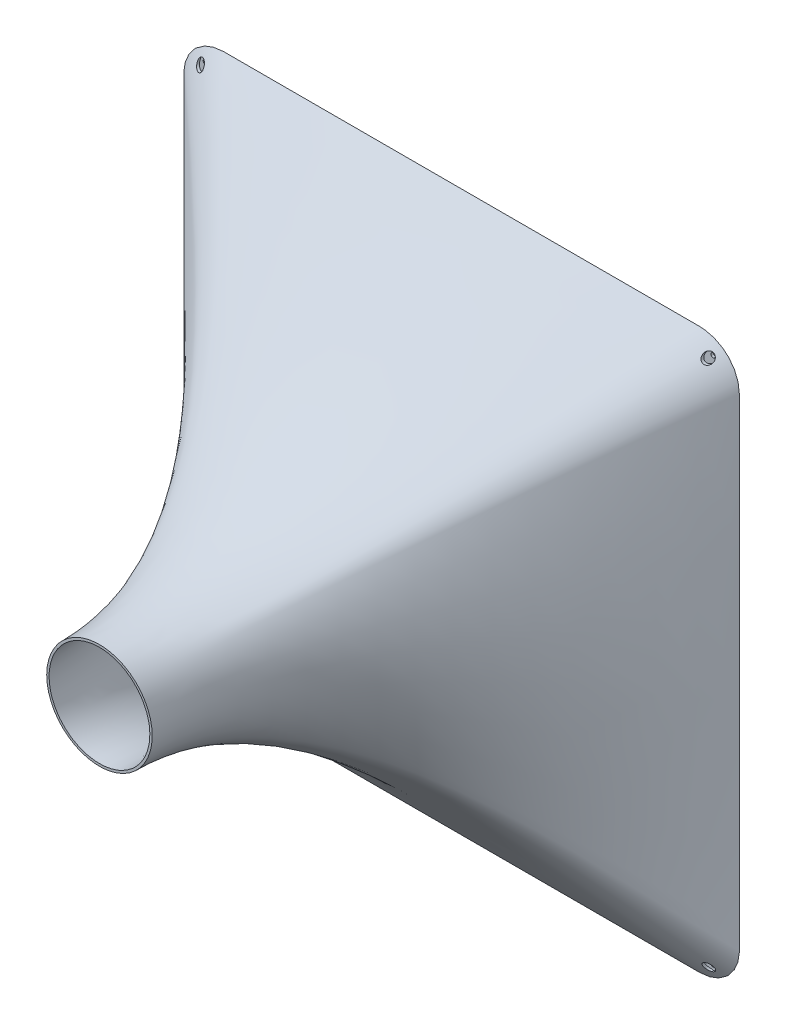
SolidWorks part; units mm, degrees
ref_plane "Front Plane" through (0, 0, 0) normal (0, 0, 1) x (1, 0, 0)
ref_plane "Top Plane" through (0, 0, 0) normal (0, 1, 0) x (1, 0, 0)
ref_plane "Right Plane" through (0, 0, 0) normal (1, 0, 0) x (0, 0, -1)
sketch "Sketch1" plane through (0, 0, 0) normal (0, 0, 1) x (1, 0, 0)
  line L4 (-300, -277.9031) -> (300, -277.9031)
  line L5 (350, -229.6068) -> (350, 378.9265)
  line L6 (300, 427.2228) -> (-300, 427.2228)
  line L7 (-350, 378.9265) -> (-350, -229.6068)
  line L8 (-300, -277.9031) -> (300, -277.9031)
  line L9 (350, -229.6068) -> (350, 378.9265)
  line L10 (300, 427.2228) -> (-300, 427.2228)
  line L11 (-350, 378.9265) -> (-350, -229.6068)
  ellipse E4 centre (-300, -229.6068) end of major axis (-350, -229.6068) minor radius 48.2963 (-350, -229.6068) -> (-300, -277.9031) ccw
  ellipse E5 centre (300, -229.6068) end of major axis (250, -229.6068) minor radius 48.2963 (300, -277.9031) -> (350, -229.6068) ccw
  ellipse E6 centre (300, 378.9265) end of major axis (250, 378.9265) minor radius 48.2963 (350, 378.9265) -> (300, 427.2228) ccw
  ellipse E7 centre (-300, 378.9265) end of major axis (-350, 378.9265) minor radius 48.2963 (-300, 427.2228) -> (-350, 378.9265) ccw
  ellipse E8 centre (-300, -229.6068) end of major axis (-350, -229.6068) minor radius 48.2963 (-350, -229.6068) -> (-300, -277.9031) ccw
  ellipse E9 centre (300, -229.6068) end of major axis (250, -229.6068) minor radius 48.2963 (300, -277.9031) -> (350, -229.6068) ccw
  ellipse E10 centre (300, 378.9265) end of major axis (250, 378.9265) minor radius 48.2963 (350, 378.9265) -> (300, 427.2228) ccw
  ellipse E11 centre (-300, 378.9265) end of major axis (-350, 378.9265) minor radius 48.2963 (-300, 427.2228) -> (-350, 378.9265) ccw
  dimension "D1" = 0
sketch "Sketch2" plane through (0, 89.1487, 456.4028) normal (0, 0, 1) x (-1, 0, 0)
  line L0 (0, 486.883) -> (0, -486.883) construction
  circle A0 centre (0, -2.5882) radius 66.5
  ellipse E1 centre (0, -2.5882) end of major axis (7.5, -2.5882) minor radius 7.2444 construction
  dimension "D1" = 133
loft "Loft1" add profiles "Sketch2", "Sketch1"
shell "Shell1" thickness 3
sketch "Sketch3" plane through (0, 0, 0) normal (0, 0, -1) x (-1, 0, 0)
  line L8 (310, -229.6068) -> (310, 378.9265)
  line L9 (300, 387.2228) -> (-300, 387.2228)
  line L10 (-310, 378.9265) -> (-310, -229.6068)
  line L11 (-300, -237.9031) -> (300, -237.9031)
  line L12 (310, -229.6068) -> (310, 378.9265)
  line L13 (300, 387.2228) -> (-300, 387.2228)
  line L14 (-310, 378.9265) -> (-310, -229.6068)
  line L15 (-300, -237.9031) -> (300, -237.9031)
  spline S0 degree 3 poles (-374.4005, 2682.8667) (100.0557, 221.6216) (240.9478, -247.1576) (302.3765, -237.6753) (302.9575, -237.5398) (303.817, -237.265) (304.1012, -237.1613) (304.6548, -236.9333) (304.9256, -236.8086) (305.7192, -236.4019) (306.224, -236.0878) (306.9404, -235.5452) (307.1736, -235.3511) (307.6172, -234.9438) (308.0383, -234.5175) (308.4132, -234.0521) (308.7633, -233.5657) (308.9267, -233.3105) (309.37, -232.5208) (309.5992, -231.9709) (316.8595, -205.5146) (176.9728, -115.4291) (-1268.1995, -2775.2615) knots -12.798799 -12.798799 -12.798799 -12.798799 0.125 0.125 0.25 0.25 0.3125 0.3125 0.375 0.375 0.5 0.5 0.5625 0.5625 0.625 0.6875 0.6875 0.75 0.75 0.875 0.875 6.501673 6.501673 6.501673 6.501673 only from (300, -237.9031) to (310, -229.6068)
  spline S1 degree 3 poles (-2619.8247, -260.5377) (-7.5812, 243.2656) (320.2876, 341.9861) (309.6828, 380.9884) (309.5844, 381.2756) (309.355, 381.8311) (309.224, 382.1) (308.9321, 382.6212) (308.7711, 382.8736) (308.4204, 383.3625) (308.2309, 383.5983) (307.6332, 384.269) (307.1924, 384.6728) (306.2334, 385.4014) (305.724, 385.7189) (304.9275, 386.1273) (304.6561, 386.2524) (304.1018, 386.4807) (303.8179, 386.5843) (302.9608, 386.8585) (302.3804, 386.9942) (260.162, 393.5241) (163.2973, 176.5513) (3022.0893, -850.4698) knots -8.256503 -8.256503 -8.256503 -8.256503 0.125 0.125 0.1875 0.1875 0.25 0.25 0.3125 0.3125 0.375 0.375 0.5 0.5 0.625 0.625 0.6875 0.6875 0.75 0.75 0.875 0.875 9.710535 9.710535 9.710535 9.710535 only from (310, 378.9265) to (300, 387.2228)
  spline S2 degree 3 poles (374.4005, -2533.5471) (-100.0557, -72.3019) (-240.9478, 396.4773) (-302.3765, 386.995) (-302.9575, 386.8594) (-303.817, 386.5846) (-304.1012, 386.4809) (-304.6548, 386.2529) (-304.9256, 386.1282) (-305.7192, 385.7215) (-306.224, 385.4075) (-306.9404, 384.8648) (-307.1736, 384.6707) (-307.6172, 384.2634) (-308.0383, 383.8372) (-308.4132, 383.3718) (-308.7633, 382.8854) (-308.9267, 382.6302) (-309.37, 381.8404) (-309.5992, 381.2905) (-316.8595, 354.8343) (-176.9728, 264.7488) (1268.1995, 2924.5812) knots -12.798799 -12.798799 -12.798799 -12.798799 0.125 0.125 0.25 0.25 0.3125 0.3125 0.375 0.375 0.5 0.5 0.5625 0.5625 0.625 0.6875 0.6875 0.75 0.75 0.875 0.875 6.501673 6.501673 6.501673 6.501673 only from (-300, 387.2228) to (-310, 378.9265)
  spline S3 degree 3 poles (2619.8247, 409.8573) (7.5812, -93.9459) (-320.2876, -192.6664) (-309.6828, -231.6688) (-309.5844, -231.956) (-309.355, -232.5115) (-309.224, -232.7803) (-308.9321, -233.3016) (-308.7711, -233.554) (-308.4204, -234.0429) (-308.2309, -234.2786) (-307.6332, -234.9493) (-307.1924, -235.3532) (-306.2334, -236.0818) (-305.724, -236.3993) (-304.9275, -236.8077) (-304.6561, -236.9327) (-304.1018, -237.1611) (-303.8179, -237.2646) (-302.9608, -237.5388) (-302.3804, -237.6745) (-260.162, -244.2044) (-163.2973, -27.2316) (-3022.0893, 999.7894) knots -8.256503 -8.256503 -8.256503 -8.256503 0.125 0.125 0.1875 0.1875 0.25 0.25 0.3125 0.3125 0.375 0.375 0.5 0.5 0.625 0.625 0.6875 0.6875 0.75 0.75 0.875 0.875 9.710535 9.710535 9.710535 9.710535 only from (-310, -229.6068) to (-300, -237.9031)
  spline S4 degree 3 poles (300, -237.9031) (300.6037, -237.9031) (301.1996, -237.857) (302.3765, -237.6753) (302.9575, -237.5398) (303.817, -237.265) (304.1012, -237.1613) (304.6548, -236.9333) (304.9256, -236.8086) (305.7192, -236.4019) (306.224, -236.0878) (306.9404, -235.5452) (307.1736, -235.3511) (307.6172, -234.9438) (308.0383, -234.5175) (308.4132, -234.0521) (308.7633, -233.5657) (308.9267, -233.3105) (309.37, -232.5208) (309.5992, -231.9709) (309.9148, -230.821) (310, -230.2143) (310, -229.6068) knots 0 0 0 0 0.125 0.125 0.25 0.25 0.3125 0.3125 0.375 0.375 0.5 0.5 0.5625 0.5625 0.625 0.6875 0.6875 0.75 0.75 0.875 0.875 1 1 1 1
  spline S5 degree 3 poles (310, 378.9265) (310, 379.5317) (309.9183, 380.1224) (309.6828, 380.9884) (309.5844, 381.2756) (309.355, 381.8311) (309.224, 382.1) (308.9321, 382.6212) (308.7711, 382.8736) (308.4204, 383.3625) (308.2309, 383.5983) (307.6332, 384.269) (307.1924, 384.6728) (306.2334, 385.4014) (305.724, 385.7189) (304.9275, 386.1273) (304.6561, 386.2524) (304.1018, 386.4807) (303.8179, 386.5843) (302.9608, 386.8585) (302.3804, 386.9942) (301.2025, 387.1764) (300.6025, 387.2228) (300, 387.2228) knots 0 0 0 0 0.125 0.125 0.1875 0.1875 0.25 0.25 0.3125 0.3125 0.375 0.375 0.5 0.5 0.625 0.625 0.6875 0.6875 0.75 0.75 0.875 0.875 1 1 1 1
  spline S6 degree 3 poles (-300, 387.2228) (-300.6037, 387.2228) (-301.1996, 387.1767) (-302.3765, 386.995) (-302.9575, 386.8594) (-303.817, 386.5846) (-304.1012, 386.4809) (-304.6548, 386.2529) (-304.9256, 386.1282) (-305.7192, 385.7215) (-306.224, 385.4075) (-306.9404, 384.8648) (-307.1736, 384.6707) (-307.6172, 384.2634) (-308.0383, 383.8372) (-308.4132, 383.3718) (-308.7633, 382.8854) (-308.9267, 382.6302) (-309.37, 381.8404) (-309.5992, 381.2905) (-309.9148, 380.1406) (-310, 379.534) (-310, 378.9265) knots 0 0 0 0 0.125 0.125 0.25 0.25 0.3125 0.3125 0.375 0.375 0.5 0.5 0.5625 0.5625 0.625 0.6875 0.6875 0.75 0.75 0.875 0.875 1 1 1 1
  spline S7 degree 3 poles (-310, -229.6068) (-310, -230.212) (-309.9183, -230.8027) (-309.6828, -231.6688) (-309.5844, -231.956) (-309.355, -232.5115) (-309.224, -232.7803) (-308.9321, -233.3016) (-308.7711, -233.554) (-308.4204, -234.0429) (-308.2309, -234.2786) (-307.6332, -234.9493) (-307.1924, -235.3532) (-306.2334, -236.0818) (-305.724, -236.3993) (-304.9275, -236.8077) (-304.6561, -236.9327) (-304.1018, -237.1611) (-303.8179, -237.2646) (-302.9608, -237.5388) (-302.3804, -237.6745) (-301.2025, -237.8567) (-300.6025, -237.9031) (-300, -237.9031) knots 0 0 0 0 0.125 0.125 0.1875 0.1875 0.25 0.25 0.3125 0.3125 0.375 0.375 0.5 0.5 0.625 0.625 0.6875 0.6875 0.75 0.75 0.875 0.875 1 1 1 1
  dimension "D1" = 40
extrude "Cut-Extrude1" cut sketch "Sketch3" against normal up to next
ref_plane "Plane1" through (0, 0, 30) normal (0, 0, 1) x (1, 0, 0)
sketch "Sketch5" plane through (0, 0, 30) normal (0, 0, 1) x (1, 0, 0)
  line L0 (0, -251.0295) -> (0, 251.0295) construction
  point P0 (0, 91.7369)
ref_plane "Plane2" through (0, 91.7369, 0) normal (0, 1, 0) x (1, 0, 0)
sketch "Sketch6" plane through (0, 0, 0) normal (0, 0, 1) x (1, 0, 0)
  line L0 (300, 427.2228) -> (-300, 427.2228) construction
  line L1 (320, -257.9031) -> (-320, -257.9031)
  line L2 (320, -257.9031) -> (320, 407.2228)
  line L3 (320, 407.2228) -> (-320, 407.2228)
  line L4 (-320, -257.9031) -> (-320, 407.2228)
  line L5 (320, -257.9031) -> (-320, 407.2228) construction
  line L6 (320, 407.2228) -> (-320, -257.9031) construction
  line L9 (-350, 378.9265) -> (-350, -229.6068) construction
  line L10 (0, -55) -> (0, 55) construction
  line L11 (-300, -277.9031) -> (300, -277.9031) construction
  line L12 (350, -229.6068) -> (350, 378.9265) construction
  point P0 (0, 74.6598)
  dimension "D1" = 20
  dimension "D2" = 30
  dimension "D3" = 20
  dimension "D4" = 30
hole_wizard "CBORE for M5 Hex Head Bolt1" positions "Sketch7" profile "Sketch8" counterbore size "M5" standard "DIN"
sketch "Sketch7" plane through (0, 0, 30) normal (0, 0, 1) x (1, 0, 0)
  point P0 (-320, 407.2228)
sketch "Sketch8" plane through (-320, 407.2228, 30) normal (1, 0, 0) x (0, -1, 0)
  line L0 (0, 0) -> (0, 31.6524)
  line L1 (0, 31.6524) -> (2.75, 30)
  line L2 (2.75, 30) -> (2.75, 27)
  line L3 (2.75, 27) -> (6.119, 27)
  line L4 (6.119, 27) -> (6.119, 0)
  line L5 (6.119, 0) -> (0, 0)
  line L10 (0, 31.6524) -> (-2.75, 30) construction
  line L11 (0, -6.35) -> (0, 107.95) construction
  dimension "Hole Dia." = 5.5
  dimension "Hole Depth" = 30
  dimension "C'Bore Dia." = 12.238
  dimension "C'Bore Depth" = 27
  dimension "Drill Angle" = 118
pattern_curve "CrvPattern2" of "CBORE for M5 Hex Head Bolt1" parameters "D1"=2, "D3"=10, "D2"=2, "D4"=10
